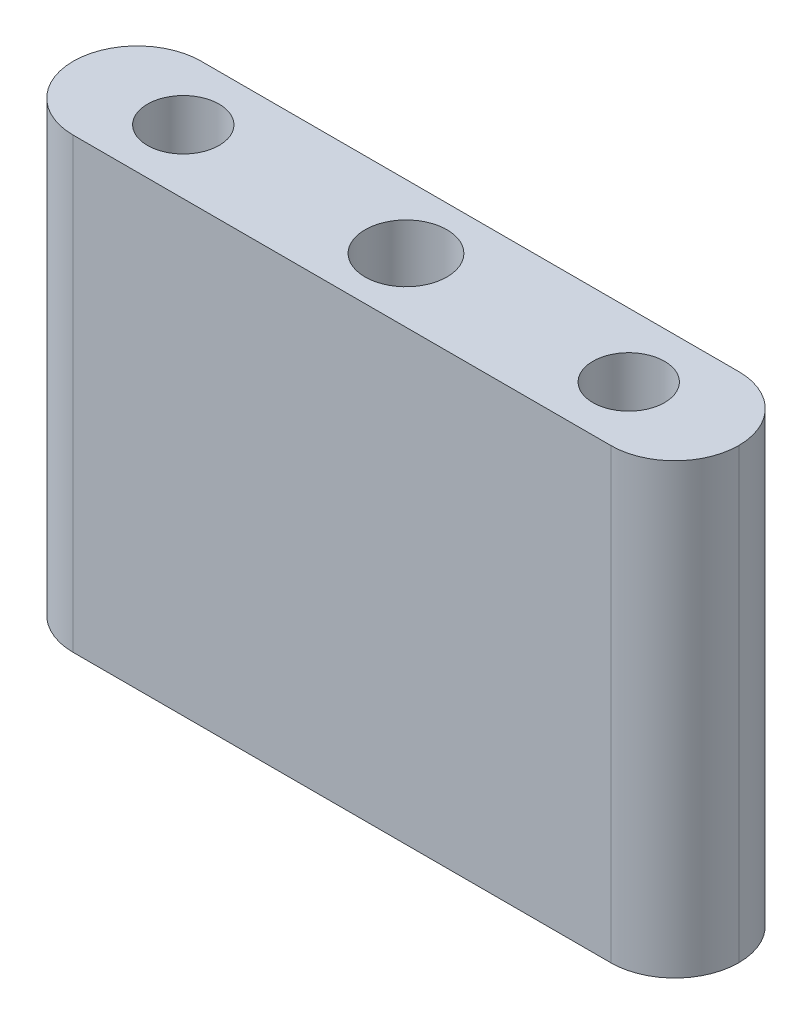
SolidWorks part; units mm, degrees
ref_plane "前视基准面" through (0, 0, 0) normal (0, 0, 1) x (1, 0, 0)
ref_plane "上视基准面" through (0, 0, 0) normal (0, 1, 0) x (1, 0, 0)
ref_plane "右视基准面" through (0, 0, 0) normal (1, 0, 0) x (0, 0, -1)
other "Configuration Table"
sketch "草图1" plane through (0, 0, 0) normal (0, 1, 0) x (1, 0, 0)
  line L0 (0, -55) -> (0, 55) construction
  line L1 (-13, 2.5) -> (13, 2.5)
  line L2 (-13, 2.5) -> (-13, -2.5)
  line L3 (-13, -2.5) -> (13, -2.5)
  line L4 (13, 2.5) -> (13, -2.5)
  line L5 (-13, 2.5) -> (13, -2.5) construction
  line L6 (-13, -2.5) -> (13, 2.5) construction
  line L7 (0, 0) -> (-4.1707, 0) construction
  circle A0 centre (-8.7, 0) radius 1.4
  circle A1 centre (8.7, 0) radius 1.4
  circle A2 centre (0, 0) radius 1.6
  point P0 (0, 0)
  dimension "D3" = 2.8
  dimension "D5" = 3.2
  dimension "D1" = 26
  dimension "D2" = 5
  dimension "D4" = 17.4
extrude "凸台-拉伸1" add sketch "草图1" along normal blind 17.5
fillet "圆角1" radius 2.5 4 edges at (13, 8.75, -2.5) (13, 8.75, 2.5) (-13, 8.75, 2.5) (-13, 8.75, -2.5)
